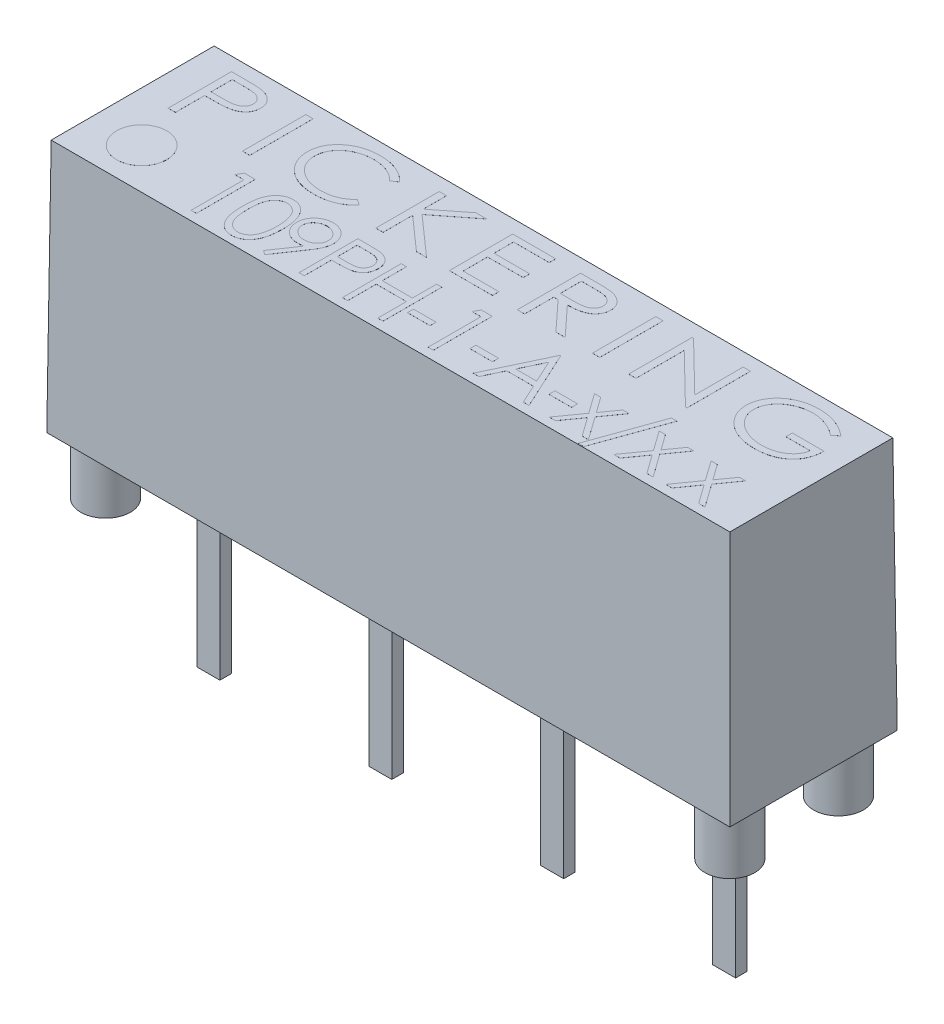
SolidWorks part; units mm, degrees
ref_plane "Front Plane" through (0, 0, 0) normal (0, 0, 1) x (1, 0, 0)
ref_plane "Top Plane" through (0, 0, 0) normal (0, 1, 0) x (1, 0, 0)
ref_plane "Right Plane" through (0, 0, 0) normal (1, 0, 0) x (0, 0, -1)
sketch "Sketch1" plane through (0, 0, 0) normal (0, 1, 0) x (1, 0, 0)
  line L1 (7.55, -1.85) -> (-7.55, -1.85)
  line L2 (7.55, -1.85) -> (7.55, 1.85)
  line L3 (7.55, 1.85) -> (-7.55, 1.85)
  line L4 (-7.55, -1.85) -> (-7.55, 1.85)
  line L5 (7.55, -1.85) -> (-7.55, 1.85) construction
  line L6 (7.55, 1.85) -> (-7.55, -1.85) construction
  point P0 (0, 0)
  dimension "D1" = 3.7
  dimension "D2" = 15.1
extrude "Main body" add sketch "Sketch1" along normal blind 5.6 draft 0.5
sketch "Sketch2" plane through (0, 0, 0) normal (0, -1, 0) x (1, 0, 0)
  line L1 (-5.446, -0.127) -> (-5.954, -0.127)
  line L2 (-5.446, -0.127) -> (-5.446, 0.127)
  line L3 (-5.446, 0.127) -> (-5.954, 0.127)
  line L4 (-5.954, -0.127) -> (-5.954, 0.127)
  line L5 (-5.446, -0.127) -> (-5.954, 0.127) construction
  line L6 (-5.446, 0.127) -> (-5.954, -0.127) construction
  line L8 (7.55, 1.85) -> (7.55, -1.85) construction
  line L9 (-2.154, -0.127) -> (-1.646, -0.127)
  line L10 (-2.154, -0.127) -> (-2.154, 0.127)
  line L11 (-2.154, 0.127) -> (-1.646, 0.127)
  line L12 (-1.646, -0.127) -> (-1.646, 0.127)
  line L13 (-2.154, -0.127) -> (-1.646, 0.127) construction
  line L14 (-2.154, 0.127) -> (-1.646, -0.127) construction
  line L15 (2.154, -0.127) -> (1.646, -0.127)
  line L16 (2.154, -0.127) -> (2.154, 0.127)
  line L17 (2.154, 0.127) -> (1.646, 0.127)
  line L18 (1.646, -0.127) -> (1.646, 0.127)
  line L19 (2.154, -0.127) -> (1.646, 0.127) construction
  line L20 (2.154, 0.127) -> (1.646, -0.127) construction
  line L21 (5.954, -0.127) -> (5.446, -0.127)
  line L22 (5.954, -0.127) -> (5.954, 0.127)
  line L23 (5.954, 0.127) -> (5.446, 0.127)
  line L24 (5.446, -0.127) -> (5.446, 0.127)
  line L25 (5.954, -0.127) -> (5.446, 0.127) construction
  line L26 (5.954, 0.127) -> (5.446, -0.127) construction
  point P0 (-5.7, 0)
  point P5 (-1.9, 0)
  point P12 (1.9, 0)
  point P17 (5.7, 0)
  dimension "D1" = 0.254
  dimension "D2" = 0.508
  dimension "D3" = 0.254
  dimension "D4" = 0.508
  dimension "D5" = 0.254
  dimension "D6" = 0.254
  dimension "D7" = 0.508
  dimension "D8" = 0.508
  dimension "D9" = 3.8
  dimension "D10" = 3.8
  dimension "D11" = 3.8
  dimension "D12" = 1.85
extrude "Pins" add sketch "Sketch2" along normal blind 4.55
sketch "Sketch3"
  dimension "D1" = 1.7
  dimension "D2" = 1.1
  dimension "D3" = 0.9
extrude "Writting" add sketch "Sketch3" along normal blind 0.001
sketch "Sketch5" plane through (0, 0, 0) normal (0, -1, 0) x (1, 0, 0)
  line L0 (-7.55, 1.85) -> (7.55, 1.85) construction
  line L1 (-7.55, -1.85) -> (-7.55, 1.85) construction
  circle A0 centre (-6.9, 1.2) radius 0.55
  dimension "D1" = 1.1
  dimension "D2" = 0.65
  dimension "D3" = 0.65
extrude "Extrude4" add sketch "Sketch5" along normal blind 1.25
mirror "foot" about plane through (0, 0, 0) normal (0, 0, 1) of "Extrude4"
mirror "feet" about plane through (0, 0, 0) normal (1, 0, 0) of "foot", "Extrude4"
